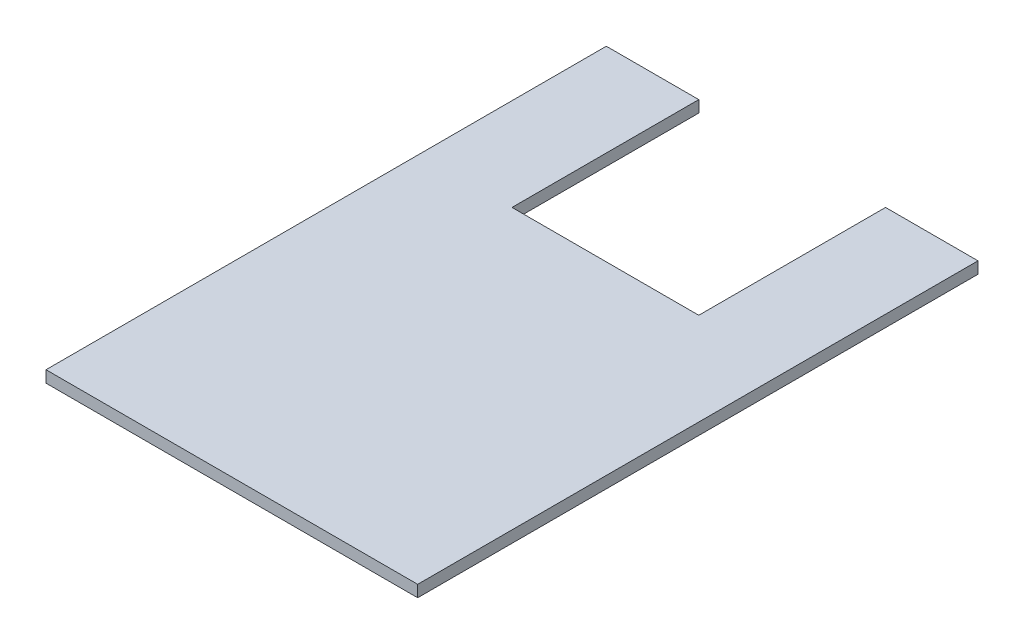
SolidWorks part; units mm, degrees
ref_plane "Front Plane" through (0, 0, 0) normal (0, 0, 1) x (1, 0, 0)
ref_plane "Top Plane" through (0, 0, 0) normal (0, 1, 0) x (1, 0, 0)
ref_plane "Right Plane" through (0, 0, 0) normal (1, 0, 0) x (0, 0, -1)
ref_plane "Front Plane-Bucket_Floor" through (0, 0, 0) normal (0, 0, 1) x (1, 0, 0)
ref_plane "Top Plane-Bucket_Floor" through (0, 0, 0) normal (0, 1, 0) x (1, 0, 0)
ref_plane "Right Plane-Bucket_Floor" through (0, 0, 0) normal (1, 0, 0) x (0, 0, -1)
sketch "Sketch1-Bucket_Floor" plane through (0, 0, 0) normal (0, 0, 1) x (1, 0, 0)
  line L0 (-50.546, 21.0608) -> (-72.8591, 67.8392)
  line L1 (50.546, -21.0608) -> (-50.546, -21.0608)
  line L2 (50.546, -21.0608) -> (50.546, 21.0608)
  line L4 (-50.546, -21.0608) -> (-50.546, 21.0608)
  line L5 (50.546, -21.0608) -> (-50.546, 21.0608) construction
  line L6 (50.546, 21.0608) -> (-50.546, -21.0608) construction
  line L7 (-72.8591, 67.8392) -> (72.8591, 67.8392)
  line L8 (72.8591, 67.8392) -> (50.546, 21.0608)
  point P0 (0, 0)
  dimension "D1" = 101.092
  dimension "D2" = 88.9
  dimension "D3" = 205.501
  dimension "D4" = 42.1217
inserted part "Bucket_Floor"
sketch "Sketch2" plane through (0, 0, 0) normal (0, 0, 1) x (1, 0, 0)
  line L0 (50.546, -21.0608) -> (50.546, 21.0608) construction
  line L1 (-50.546, -21.0608) -> (50.546, -21.0608)
  line L2 (-50.546, -21.0608) -> (-50.546, -17.8858)
  line L3 (-50.546, -17.8858) -> (50.546, -17.8858)
  line L4 (50.546, -21.0608) -> (50.546, -17.8858)
  dimension "D1" = 3.175
extrude "Boss-Extrude1" add sketch "Sketch2" along normal blind 152.4
sketch "Sketch3" plane through (0, -21.0608, 0) normal (0, -1, 0) x (1, 0, 0)
  line L0 (-72.8591, 0) -> (72.8591, 0) construction
  line L1 (-25.4, 0) -> (25.4, 0)
  line L2 (-25.4, 0) -> (-25.4, 50.8)
  line L3 (-25.4, 50.8) -> (25.4, 50.8)
  line L4 (25.4, 0) -> (25.4, 50.8)
  point P6 (0, 50.8)
  dimension "D1" = 50.8
  dimension "D2" = 50.8
extrude "Cut-Extrude1" cut sketch "Sketch3" against normal up to next
